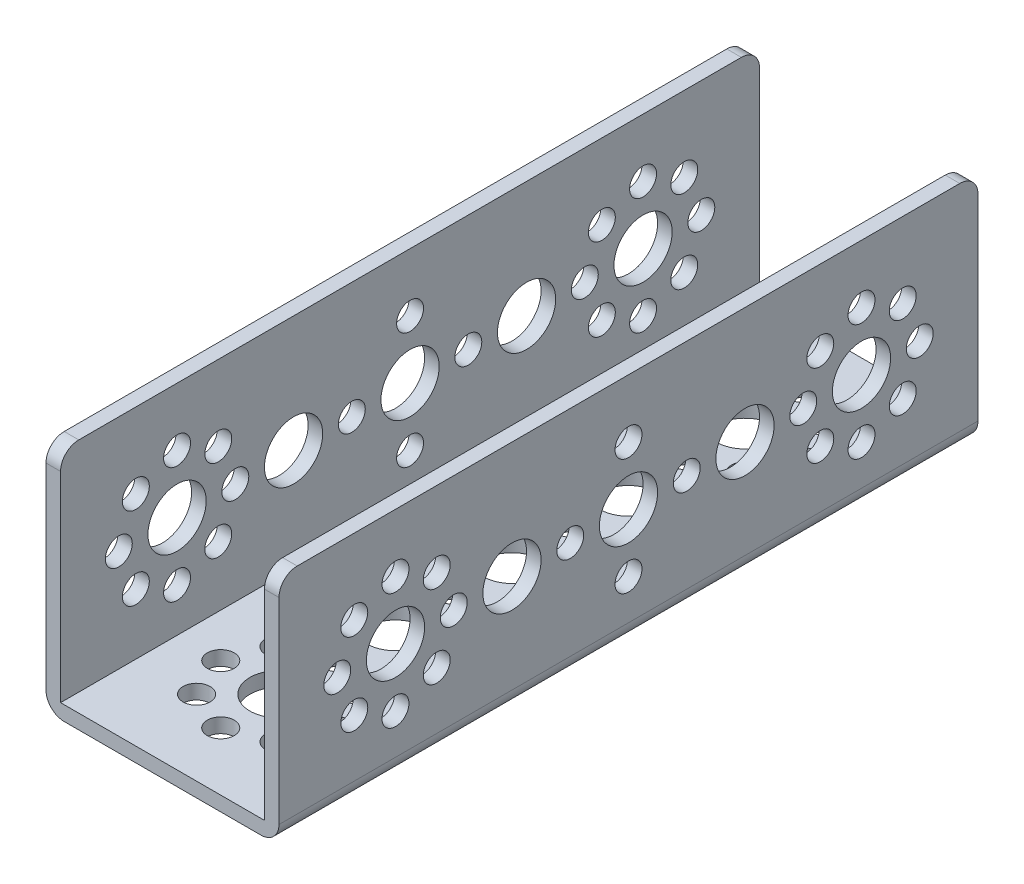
SolidWorks part; units mm, degrees
ref_plane "Front Plane" through (0, 0, 0) normal (0, 0, 1) x (1, 0, 0)
ref_plane "Top Plane" through (0, 0, 0) normal (0, 1, 0) x (1, 0, 0)
ref_plane "Right Plane" through (0, 0, 0) normal (1, 0, 0) x (0, 0, -1)
sketch "Sketch1" plane through (0, 0, 0) normal (0, 0, 1) x (1, 0, 0)
  line L0 (2.5, 0) -> (29.5, 0)
  line L1 (32, 2.5) -> (32, 32)
  line L2 (32, 32) -> (30, 32)
  line L3 (30, 32) -> (30, 2)
  line L4 (30, 2) -> (2, 2)
  line L5 (2, 2) -> (2, 32)
  line L6 (2, 32) -> (0, 32)
  line L7 (0, 32) -> (0, 2.5)
  arc A0 (0, 2.5) -> (2.5, 0) centre (2.5, 2.5) ccw
  arc A1 (32, 2.5) -> (29.5, 0) centre (29.5, 2.5) cw
  point P11 (0, 0)
  point P14 (32, 0)
  dimension "D7" = 2.5
  dimension "D1" = 32
  dimension "D2" = 2
  dimension "D3" = 2
  dimension "D4" = 2
  dimension "D5" = 32
  dimension "D6" = 32
extrude "Extrude1" add sketch "Sketch1" along normal blind 96
sketch "Sketch2"
sketch_block_instance "Block3-1"
sketch_block "Block3"
sketch_block_instance "Block2-2"
sketch_block "Block2"
sketch_block_instance "Block2-1"
extrude "Cut-Extrude1" cut sketch "Sketch2" against normal blind 32
sketch "Sketch6" plane through (0, 2, 0) normal (0, 1, 0) x (1, 0, 0)
  circle B0 centre (16, -72) radius 1.85
  circle B1 centre (24, -80) radius 1.85
  circle B2 centre (16, -80) radius 4
  circle B3 centre (8, -80) radius 1.85
  circle B4 centre (10.34, -85.66) radius 1.85
  circle B5 centre (21.66, -85.66) radius 1.85
  circle B6 centre (16, -88) radius 1.85
  circle B7 centre (10.34, -74.34) radius 1.85
  circle B8 centre (21.66, -74.34) radius 1.85
  circle B9 centre (16, -48) radius 4
  circle B10 centre (16, -40) radius 1.85
  circle B11 centre (16, -56) radius 1.85
  circle B12 centre (24, -48) radius 1.85
  circle B13 centre (8, -48) radius 1.85
  circle B14 centre (16, -64) radius 4
  circle B15 centre (16, -32) radius 4
  circle B16 centre (16, -16) radius 4
  circle B17 centre (16, -8) radius 1.85
  circle B18 centre (16, -24) radius 1.85
  circle B19 centre (24, -16) radius 1.85
  circle B20 centre (8, -16) radius 1.85
  circle B21 centre (10.34, -21.66) radius 1.85
  circle B22 centre (10.34, -10.34) radius 1.85
  circle B23 centre (21.66, -10.34) radius 1.85
  circle B24 centre (21.66, -21.66) radius 1.85
  dimension "D1" = 48
  dimension "D2" = 16
sketch_block_instance "Block3-4"
extrude "Cut-Extrude2" cut sketch "Sketch6" against normal blind 2
fillet "Fillet1" radius 2.5 1 edges at (1, 32, 96)
fillet "Fillet2" radius 2.5 3 edges at (1, 32, 0) (31, 32, 0) (31, 32, 96)
